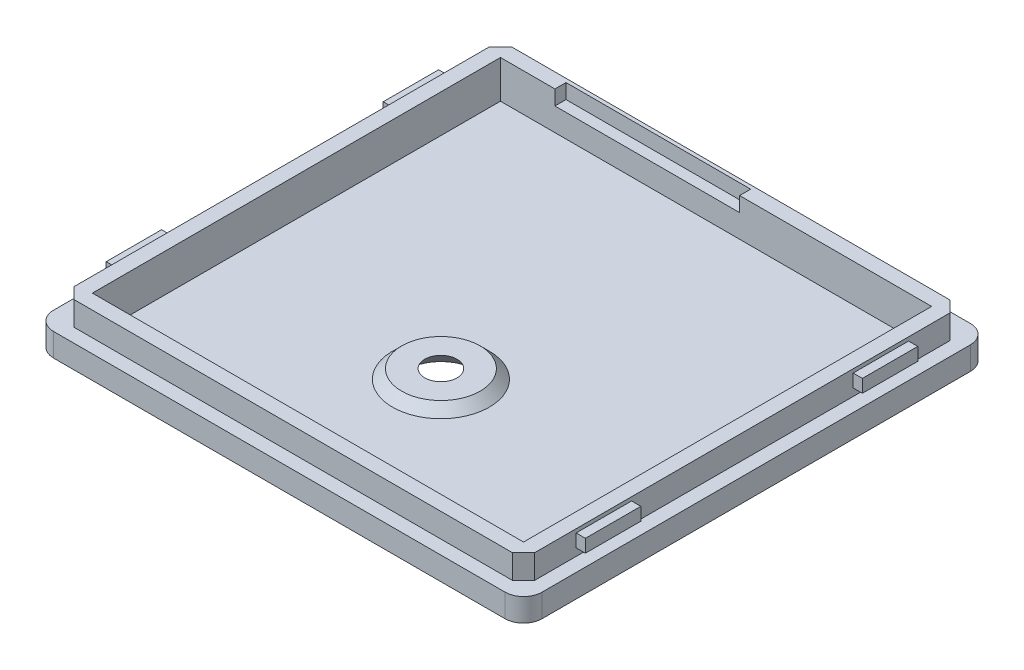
SolidWorks part; units mm, degrees
ref_plane "Спереди" through (0, 0, 0) normal (0, 0, 1) x (1, 0, 0)
ref_plane "Сверху" through (0, 0, 0) normal (0, 1, 0) x (1, 0, 0)
ref_plane "Справа" through (0, 0, 0) normal (1, 0, 0) x (0, 0, -1)
sketch "Эскиз1" plane through (0, 0, 0) normal (0, 1, 0) x (1, 0, 0)
  line L1 (-24.45, -25.2) -> (24.45, -25.2)
  line L2 (-26.45, -23.2) -> (-26.45, 23.2)
  line L3 (-24.45, 25.2) -> (24.45, 25.2)
  line L4 (26.45, -23.2) -> (26.45, 23.2)
  line L5 (-26.45, -25.2) -> (26.45, 25.2) construction
  line L6 (-26.45, 25.2) -> (26.45, -25.2) construction
  arc A0 (24.45, 25.2) -> (26.45, 23.2) centre (24.45, 23.2) cw
  arc A1 (24.45, -25.2) -> (26.45, -23.2) centre (24.45, -23.2) ccw
  arc A2 (-24.45, -25.2) -> (-26.45, -23.2) centre (-24.45, -23.2) cw
  arc A3 (-26.45, 23.2) -> (-24.45, 25.2) centre (-24.45, 23.2) cw
  point P0 (0, 0)
  dimension "D3" = 2
  dimension "D1" = 52.9
  dimension "D2" = 50.4
extrude "Бобышка-Вытянуть1" add sketch "Эскиз1" along normal blind 1
ref_plane "Плоскость1" through (0, 0, 0) normal (0, -1, 0) x (-1, 0, 0)
sketch "Эскиз2" plane through (0, 0, 0) normal (0, -1, 0) x (-1, 0, 0)
  line L60 (-24.45, -25.2) -> (24.45, -25.2)
  line L61 (-26.45, 23.2) -> (-26.45, -23.2)
  line L62 (24.45, 25.2) -> (-24.45, 25.2)
  line L63 (26.45, -23.2) -> (26.45, 23.2)
  line L64 (-24.45, -25.2) -> (24.45, -25.2)
  line L65 (-26.45, 23.2) -> (-26.45, -23.2)
  line L66 (24.45, 25.2) -> (-24.45, 25.2)
  line L67 (26.45, -23.2) -> (26.45, 23.2)
  line L72 (24.45, 23.9) -> (-24.45, 23.9)
  line L73 (25.15, -23.2) -> (25.15, 23.2)
  line L74 (-24.45, -23.9) -> (24.45, -23.9)
  line L75 (-25.15, 23.2) -> (-25.15, -23.2)
  line L76 (24.45, 23.9) -> (-24.45, 23.9)
  line L77 (25.15, -23.2) -> (25.15, 23.2)
  line L78 (-24.45, -23.9) -> (24.45, -23.9)
  line L79 (-25.15, 23.2) -> (-25.15, -23.2)
  arc A55 (24.45, -25.2) -> (26.45, -23.2) centre (24.45, -23.2) ccw
  arc A56 (-26.45, -23.2) -> (-24.45, -25.2) centre (-24.45, -23.2) ccw
  arc A57 (-24.45, 25.2) -> (-26.45, 23.2) centre (-24.45, 23.2) ccw
  arc A58 (26.45, 23.2) -> (24.45, 25.2) centre (24.45, 23.2) ccw
  arc A59 (24.45, -25.2) -> (26.45, -23.2) centre (24.45, -23.2) ccw
  arc A60 (-26.45, -23.2) -> (-24.45, -25.2) centre (-24.45, -23.2) ccw
  arc A61 (-24.45, 25.2) -> (-26.45, 23.2) centre (-24.45, 23.2) ccw
  arc A62 (26.45, 23.2) -> (24.45, 25.2) centre (24.45, 23.2) ccw
  arc A67 (-24.45, 23.9) -> (-25.15, 23.2) centre (-24.45, 23.2) ccw
  arc A68 (25.15, 23.2) -> (24.45, 23.9) centre (24.45, 23.2) ccw
  arc A69 (24.45, -23.9) -> (25.15, -23.2) centre (24.45, -23.2) ccw
  arc A70 (-25.15, -23.2) -> (-24.45, -23.9) centre (-24.45, -23.2) ccw
  arc A71 (-24.45, 23.9) -> (-25.15, 23.2) centre (-24.45, 23.2) ccw
  arc A72 (25.15, 23.2) -> (24.45, 23.9) centre (24.45, 23.2) ccw
  arc A73 (24.45, -23.9) -> (25.15, -23.2) centre (24.45, -23.2) ccw
  arc A74 (-25.15, -23.2) -> (-24.45, -23.9) centre (-24.45, -23.2) ccw
  dimension "D1" = 0
  dimension "D2" = 1.3
extrude "Бобышка-Вытянуть2" add sketch "Эскиз2" against normal blind 2.5
ref_plane "Плоскость2" through (0, 0, 0) normal (0, -1, 0) x (-1, 0, 0)
sketch "Эскиз3" plane through (0, 0, 0) normal (0, -1, 0) x (-1, 0, 0)
  circle A0 centre (0.5, -7.2) radius 1.25
  point P2 (1.3044, -7.2)
  dimension "D3" = 2.5
  dimension "D1" = 0.5
  dimension "D2" = 7.2
extrude "Вырез-Вытянуть1" cut sketch "Эскиз3" against normal through all
ref_plane "Плоскость3" through (0, 1, 0) normal (0, 1, 0) x (1, 0, 0)
sketch "Эскиз4" plane through (0, 1, 0) normal (0, 1, 0) x (1, 0, 0)
  circle A0 centre (-0.5, -7.2) radius 3.75
  circle A1 centre (-0.5, -7.2) radius 1.25
  circle A2 centre (-0.5, -7.2) radius 1.25 construction
  dimension "D1" = 2.5
extrude "Бобышка-Вытянуть3" add sketch "Эскиз4" along normal blind 1
chamfer "Фаска1" distance 2.5 angle 45 1 edges at (-0.5, 0, 5.95)
ref_plane "Плоскость4" through (0, 1, 0) normal (0, 1, 0) x (1, 0, 0)
sketch "Эскиз5" plane through (0, 1, 0) normal (0, 1, 0) x (1, 0, 0)
  line L8 (23.35, 22.1) -> (-23.35, 22.1)
  line L9 (-23.35, 22.1) -> (-23.35, -22.1)
  line L10 (-23.35, -22.1) -> (23.35, -22.1)
  line L11 (23.35, -22.1) -> (23.35, 22.1)
  line L12 (23.35, 22.1) -> (-23.35, 22.1)
  line L13 (-23.35, 22.1) -> (-23.35, -22.1)
  line L14 (-23.35, -22.1) -> (23.35, -22.1)
  line L15 (23.35, -22.1) -> (23.35, 22.1)
  line L20 (24.45, 23.9) -> (-24.45, 23.9)
  line L21 (-25.15, 23.2) -> (-25.15, -23.2)
  line L22 (-24.45, -23.9) -> (24.45, -23.9)
  line L23 (25.15, -23.2) -> (25.15, 23.2)
  line L24 (24.45, 23.9) -> (-24.45, 23.9)
  line L25 (-25.15, 23.2) -> (-25.15, -23.2)
  line L26 (-24.45, -23.9) -> (24.45, -23.9)
  line L27 (25.15, -23.2) -> (25.15, 23.2)
  arc A12 (25.15, 23.2) -> (24.45, 23.9) centre (24.45, 23.2) ccw
  arc A13 (-24.45, 23.9) -> (-25.15, 23.2) centre (-24.45, 23.2) ccw
  arc A14 (-25.15, -23.2) -> (-24.45, -23.9) centre (-24.45, -23.2) ccw
  arc A15 (24.45, -23.9) -> (25.15, -23.2) centre (24.45, -23.2) ccw
  arc A16 (25.15, 23.2) -> (24.45, 23.9) centre (24.45, 23.2) ccw
  arc A17 (-24.45, 23.9) -> (-25.15, 23.2) centre (-24.45, 23.2) ccw
  arc A18 (-25.15, -23.2) -> (-24.45, -23.9) centre (-24.45, -23.2) ccw
  arc A19 (24.45, -23.9) -> (25.15, -23.2) centre (24.45, -23.2) ccw
  dimension "D1" = 1.8
  dimension "D2" = 0
extrude "Бобышка-Вытянуть4" add sketch "Эскиз5" along normal blind 4.1
ref_plane "Плоскость5" through (0, 5.1, 0) normal (0, 1, 0) x (1, 0, 0)
sketch "Эскиз6" plane through (0, 5.1, 0) normal (0, 1, 0) x (1, 0, 0)
  line L0 (23.35, 22.1) -> (-23.35, 22.1) construction
  line L1 (-17.45, 22.1) -> (2.55, 22.1)
  line L2 (-17.45, 22.1) -> (-17.45, 23.3)
  line L3 (-17.45, 23.3) -> (2.55, 23.3)
  line L4 (2.55, 22.1) -> (2.55, 23.3)
  line L5 (24.45, 23.9) -> (-24.45, 23.9) construction
  line L6 (-26.45, -23.2) -> (-26.45, 23.2) construction
  dimension "D1" = 0.6
  dimension "D2" = 20
  dimension "D3" = 9
extrude "Вырез-Вытянуть2" cut sketch "Эскиз6" against normal offset from surface (1.6 mm away) 1
ref_plane "Плоскость6" through (0, 5.1, 0) normal (0, 1, 0) x (1, 0, 0)
sketch "Эскиз7" plane through (0, 5.1, 0) normal (0, 1, 0) x (1, 0, 0)
  line L8 (24.45, 23.7) -> (-24.45, 23.7)
  line L9 (-24.95, 23.2) -> (-24.95, -23.2)
  line L10 (-24.45, -23.7) -> (24.45, -23.7)
  line L11 (24.95, -23.2) -> (24.95, 23.2)
  line L12 (24.45, 23.7) -> (-24.45, 23.7)
  line L13 (-24.95, 23.2) -> (-24.95, -23.2)
  line L14 (-24.45, -23.7) -> (24.45, -23.7)
  line L15 (24.95, -23.2) -> (24.95, 23.2)
  line L20 (-26.45, 23.2) -> (-26.45, -23.2)
  line L21 (-24.45, -25.2) -> (24.45, -25.2)
  line L22 (26.45, -23.2) -> (26.45, 23.2)
  line L23 (24.45, 25.2) -> (-24.45, 25.2)
  line L24 (-26.45, 23.2) -> (-26.45, -23.2)
  line L25 (-24.45, -25.2) -> (24.45, -25.2)
  line L26 (26.45, -23.2) -> (26.45, 23.2)
  line L27 (24.45, 25.2) -> (-24.45, 25.2)
  arc A16 (24.95, 23.2) -> (24.45, 23.7) centre (24.45, 23.2) ccw
  arc A17 (24.95, 23.2) -> (24.45, 23.7) centre (24.45, 23.2) ccw
  arc A18 (-24.45, 23.7) -> (-24.95, 23.2) centre (-24.45, 23.2) ccw
  arc A19 (-24.45, 23.7) -> (-24.95, 23.2) centre (-24.45, 23.2) ccw
  arc A20 (-24.45, 25.2) -> (-26.45, 23.2) centre (-24.45, 23.2) ccw
  arc A21 (-26.45, -23.2) -> (-24.45, -25.2) centre (-24.45, -23.2) ccw
  arc A22 (24.45, -25.2) -> (26.45, -23.2) centre (24.45, -23.2) ccw
  arc A23 (26.45, 23.2) -> (24.45, 25.2) centre (24.45, 23.2) ccw
  arc A24 (-24.45, 25.2) -> (-26.45, 23.2) centre (-24.45, 23.2) ccw
  arc A25 (-26.45, -23.2) -> (-24.45, -25.2) centre (-24.45, -23.2) ccw
  arc A26 (24.45, -25.2) -> (26.45, -23.2) centre (24.45, -23.2) ccw
  arc A27 (26.45, 23.2) -> (24.45, 25.2) centre (24.45, 23.2) ccw
  arc A28 (-24.95, -23.2) -> (-24.45, -23.7) centre (-24.45, -23.2) ccw
  arc A29 (-24.95, -23.2) -> (-24.45, -23.7) centre (-24.45, -23.2) ccw
  arc A30 (24.45, -23.7) -> (24.95, -23.2) centre (24.45, -23.2) ccw
  arc A31 (24.45, -23.7) -> (24.95, -23.2) centre (24.45, -23.2) ccw
  dimension "D1" = 0.2
  dimension "D2" = 0
extrude "Вырез-Вытянуть3" cut sketch "Эскиз7" against normal up to surface (2.6 mm away)
ref_plane "Плоскость7" through (-24.95, 0, 0) normal (-1, 0, 0) x (0, 0, 1)
sketch "Эскиз8" plane through (-24.95, 0, 0) normal (-1, 0, 0) x (0, 0, 1)
  line L0 (0, 0) -> (0, 5.1) construction
  line L1 (-23.2, 5.1) -> (23.2, 5.1) construction
  line L2 (-23.7, 4) -> (23.2, 4) construction
  line L3 (-23.7, 2.5) -> (-23.7, 5.1) construction
  line L4 (23.2, 2.5) -> (23.2, 5.1) construction
  line L5 (25.96, 5.1) -> (-25.96, 5.1) construction
  line L6 (-18, 3.3) -> (-12, 3.3)
  line L7 (-18, 3.3) -> (-18, 4.7)
  line L8 (-18, 4.7) -> (-12, 4.7)
  line L9 (-12, 3.3) -> (-12, 4.7)
  line L10 (-18, 3.3) -> (-12, 4.7) construction
  line L11 (-18, 4.7) -> (-12, 3.3) construction
  line L12 (18, 4.7) -> (12, 3.3) construction
  line L13 (18, 3.3) -> (12, 4.7) construction
  line L14 (12, 3.3) -> (12, 4.7)
  line L15 (18, 4.7) -> (12, 4.7)
  line L16 (18, 3.3) -> (18, 4.7)
  line L17 (18, 3.3) -> (12, 3.3)
  point P11 (-15, 4)
  point P22 (15, 4)
  dimension "D1" = 6
  dimension "D2" = 15
  dimension "D3" = 1.1
  dimension "D4" = 1.4
extrude "Бобышка-Вытянуть5" add sketch "Эскиз8" along normal blind 1
ref_plane "Плоскость8" through (0, 0, 0) normal (1, 0, 0) x (0, 0, -1)
mirror "Зеркальное отражение1" about plane through (0, 0, 0) normal (1, 0, 0) of "Бобышка-Вытянуть5"
chamfer "Фаска2" distance 1.5 angle 45 1 edges at (-0.5, 1, 3.45)
ref_plane "Плоскость9" through (0, 5.1, 0) normal (0, 1, 0) x (1, 0, 0)
sketch "Эскиз9" plane through (0, 5.1, 0) normal (0, 1, 0) x (1, 0, 0)
  line L0 (-24.95, 22.5) -> (-23.75, 23.7)
  line L1 (-24.95, 1.43) -> (-24.95, -1.43) construction
  line L2 (24.45, 23.7) -> (-24.45, 23.7) construction
  line L3 (-24.95, 22.5) -> (-24.95, 23.7)
  line L4 (-24.95, 23.7) -> (-23.75, 23.7)
  line L5 (23.75, 23.7) -> (24.95, 22.5)
  line L6 (24.45, 23.7) -> (-24.45, 23.7) construction
  line L7 (24.95, -23.2) -> (24.95, 23.2) construction
  line L8 (24.95, 22.5) -> (24.95, 23.7)
  line L9 (24.95, 23.7) -> (23.75, 23.7)
  line L10 (-24.95, 0) -> (24.95, 0) construction
  line L17 (24.95, -23.7) -> (23.75, -23.7)
  line L18 (24.95, -22.5) -> (24.95, -23.7)
  line L19 (23.75, -23.7) -> (24.95, -22.5)
  line L20 (-24.95, -23.7) -> (-23.75, -23.7)
  line L21 (-24.95, -22.5) -> (-24.95, -23.7)
  line L22 (-24.95, -22.5) -> (-23.75, -23.7)
  point P22 (-24.95, -23.923)
  point P23 (-24.95, 23.7)
  dimension "D1" = 1.2
  dimension "D2" = 1.2
  dimension "D3" = 1.2
  dimension "D4" = 1.2
extrude "Вырез-Вытянуть4" cut sketch "Эскиз9" against normal up to surface (2.6 mm away)
